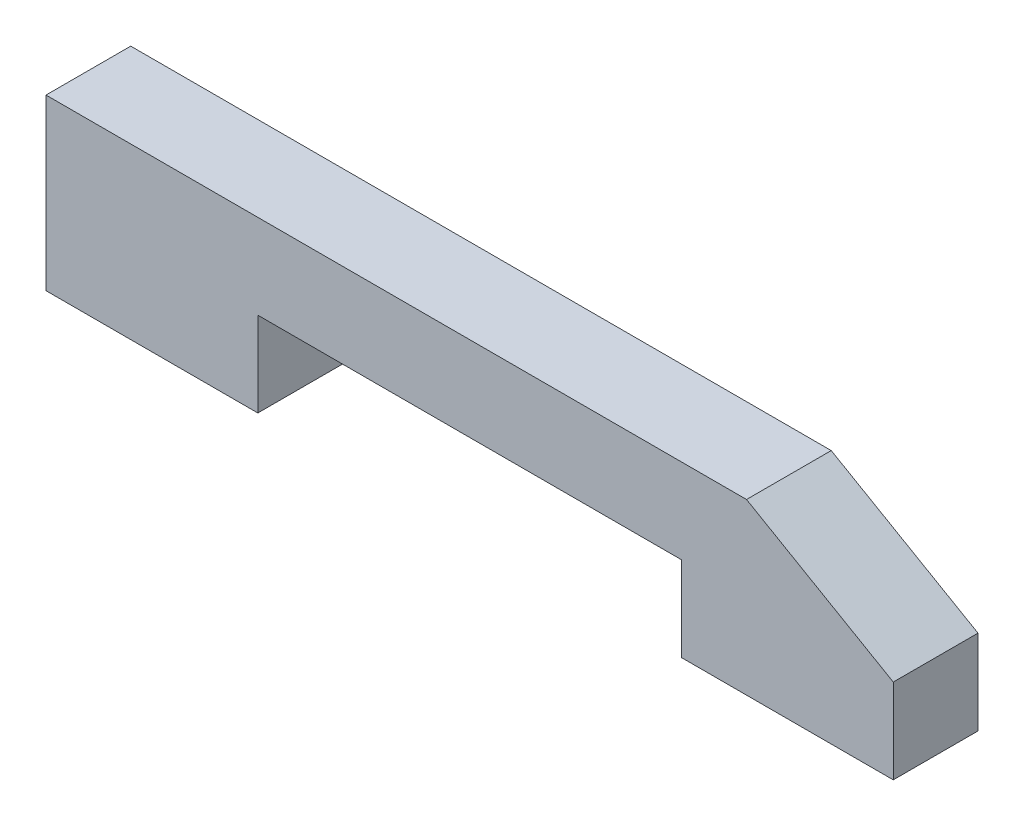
SolidWorks part; units mm, degrees
ref_plane "Plan de face" through (0, 0, 0) normal (0, 0, 1) x (1, 0, 0)
ref_plane "Plan de dessus" through (0, 0, 0) normal (0, 1, 0) x (1, 0, 0)
ref_plane "Plan de droite" through (0, 0, 0) normal (1, 0, 0) x (0, 0, -1)
sketch "Esquisse1" plane through (0, 0, 0) normal (0, 0, 1) x (1, 0, 0)
  line L0 (0, 0) -> (0, 6)
  line L1 (0, 6) -> (30, 6)
  line L2 (30, 6) -> (30, 0)
  line L3 (30, 0) -> (22.5, 0)
  line L4 (22.5, 0) -> (22.5, 3)
  line L5 (22.5, 3) -> (7.5, 3)
  line L6 (7.5, 3) -> (7.5, 0)
  line L7 (7.5, 0) -> (0, 0)
  line L8 (15, 3) -> (15, 6) construction
  dimension "D1" = 30
  dimension "D2" = 15
  dimension "D3" = 3
  dimension "D4" = 3
extrude "Boss.-Extru.1" add sketch "Esquisse1" along normal blind 3
chamfer "Chanfrein1" distance 3 angle 60 1 edges at (30, 6, 1.5)
ref_plane "Plan1" through (15, 0, 0) normal (-1, 0, 0) x (0, 0, 1)
equation "\"30g\"=60"
